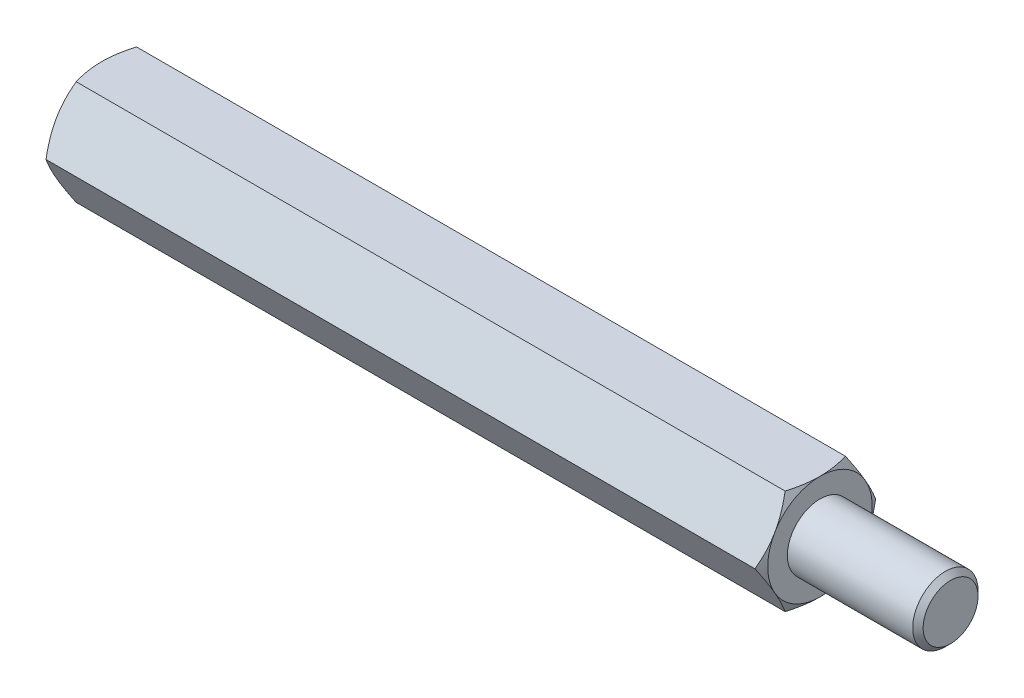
SolidWorks part; units mm, degrees
ref_plane "Front Plane" through (0, 0, 0) normal (0, 0, 1) x (1, 0, 0)
ref_plane "Top Plane" through (0, 0, 0) normal (0, 1, 0) x (1, 0, 0)
ref_plane "Right Plane" through (0, 0, 0) normal (1, 0, 0) x (0, 0, -1)
sketch "Sketch1" plane through (0, 0, 0) normal (1, 0, 0) x (0, 0, -1)
  line L1 (2.3094, 4) -> (-2.3094, 4)
  line L2 (-2.3094, 4) -> (-4.6188, 0)
  line L3 (-4.6188, 0) -> (-2.3094, -4)
  line L4 (-2.3094, -4) -> (2.3094, -4)
  line L5 (2.3094, -4) -> (4.6188, 0)
  line L6 (4.6188, 0) -> (2.3094, 4)
  circle A0 centre (0, 0) radius 4 construction
  dimension "D1" = 8
extrude "Extrude2" add sketch "Sketch1" along normal mid plane 55
sketch "Sketch2" plane through (0, 0, 0) normal (0, 0, 1) x (1, 0, 0)
  line L0 (-27.5, 4) -> (-26, 6.5981)
  line L1 (-27.5, 7) -> (-27.5, 4)
  line L3 (0, 0) -> (50000, 0) construction
  arc A0 (-26, 6.5981) -> (-27.5, 7) centre (-26.6962, 7) ccw
  dimension "D1" = 30
  dimension "D2" = 3
revolve "Cut-Revolve1" cut sketch "Sketch2" angle 360 about L3
mirror "Mirror1" about plane through (0, 0, 0) normal (1, 0, 0) of "Cut-Revolve1"
sketch "Sketch3" plane through (-27.5, 0, 0) normal (-1, 0, 0) x (0, 0, 1)
  circle A0 centre (0, 0) radius 2.1
  dimension "D1" = 4.2
extrude "Extrude3" cut sketch "Sketch3" against normal blind 10
sketch "Sketch4" plane through (0, 0, 0) normal (0, 0, 1) x (1, 0, 0)
  line L0 (-17.5, 0) -> (-17.5, 2.1)
  line L1 (27.1427, 0) -> (-27.1427, 0) construction
  line L2 (-17.5, 2.1) -> (-16.2876, 0)
  line L3 (-16.2876, 0) -> (-17.5, 0)
  line L4 (-27.5, 2) -> (-27.5, -2) construction
  point P4 (-27.5, 0)
  dimension "D1" = 30
  dimension "D2" = 2.1
  dimension "D3" = 10
revolve "Cut-Revolve2" cut sketch "Sketch4" angle 360 about L3
sketch "Sketch5" plane through (27.5, 0, 0) normal (1, 0, 0) x (0, 0, -1)
  circle A0 centre (0, 0) radius 2.5
  dimension "D1" = 5
extrude "Extrude4" add sketch "Sketch5" along normal blind 10
chamfer "Chamfer1" distance 0.4 angle 45 1 edges at (37.5, 0, -2.5)
equation "\"D2@Sketch4\" = \"D1@Sketch3\"/2"
